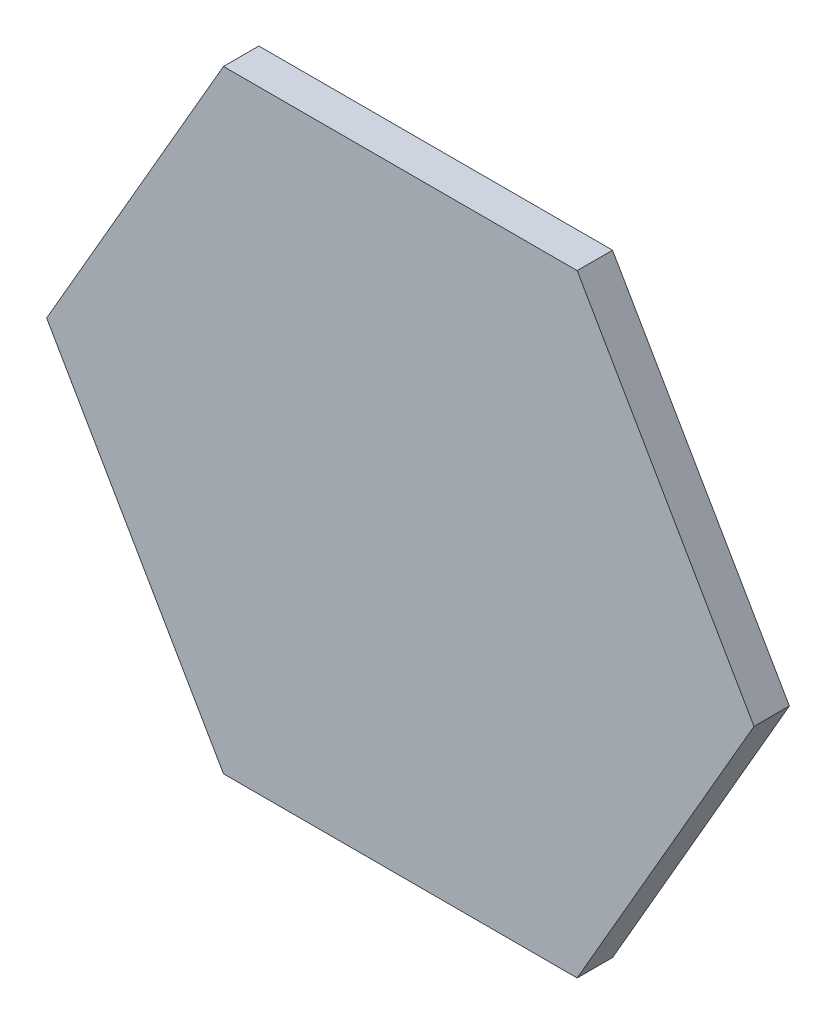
SolidWorks part; units mm, degrees
ref_plane "Front Plane" through (0, 0, 0) normal (0, 0, 1) x (1, 0, 0)
ref_plane "Top Plane" through (0, 0, 0) normal (0, 1, 0) x (1, 0, 0)
ref_plane "Right Plane" through (0, 0, 0) normal (1, 0, 0) x (0, 0, -1)
sketch "Sketch1" plane through (0, 0, 0) normal (0, 0, 1) x (1, 0, 0)
  line L1 (25.4, 0) -> (12.7, 21.997)
  line L2 (12.7, 21.997) -> (-12.7, 21.997)
  line L3 (-12.7, 21.997) -> (-25.4, 0)
  line L4 (-25.4, 0) -> (-12.7, -21.997)
  line L5 (-12.7, -21.997) -> (12.7, -21.997)
  line L6 (12.7, -21.997) -> (25.4, 0)
  circle A0 centre (0, 0) radius 21.997 construction
  dimension "D1" = 25.4
extrude "Boss-Extrude1" add sketch "Sketch1" along normal mid plane 2.54
